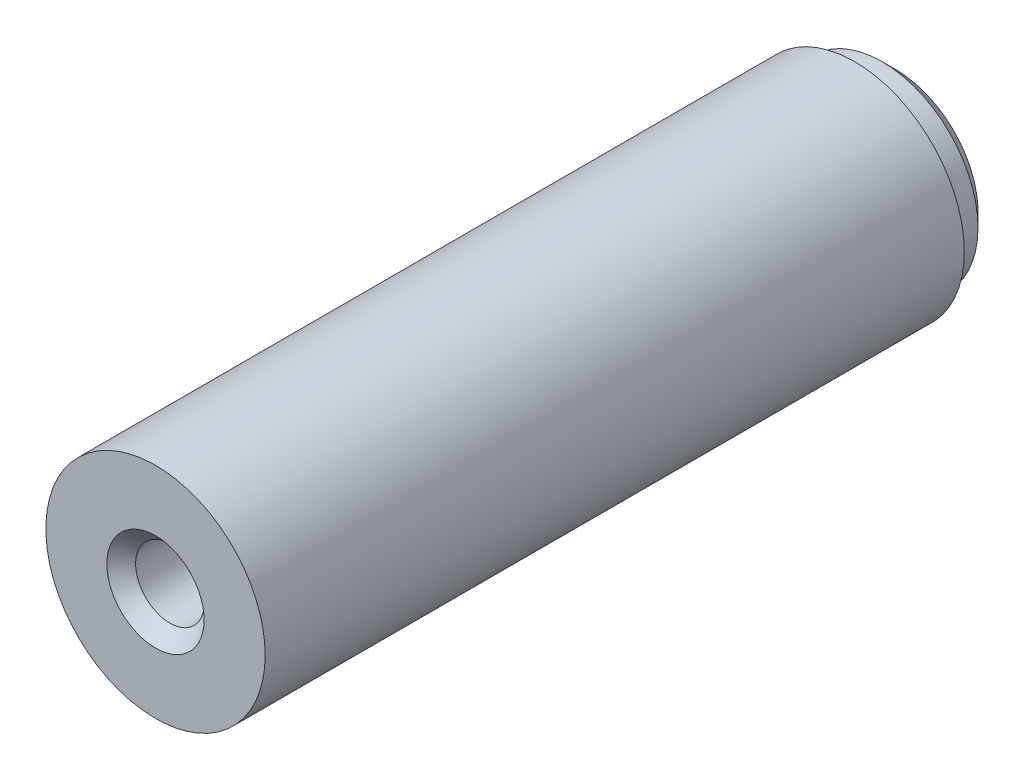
SolidWorks part; units mm, degrees
ref_plane "Přední rovina" through (0, 0, 0) normal (0, 0, 1) x (1, 0, 0)
ref_plane "Horní rovina" through (0, 0, 0) normal (0, 1, 0) x (1, 0, 0)
ref_plane "Pravá rovina" through (0, 0, 0) normal (1, 0, 0) x (0, 0, -1)
sketch "Skica1" plane through (0, 0, 0) normal (0, 0, 1) x (1, 0, 0)
  circle A0 centre (0, 0) radius 4
  dimension "D1" = 8
extrude "Přidat vysunutím1" add sketch "Skica1" along normal blind 25.5
hole_wizard "M3 závit1" positions "Skica3" profile "Skica2" tap size "M3" standard "ISO"
sketch "Skica3" plane through (0, 0, 25.5) normal (0, 0, 1) x (1, 0, 0)
  point P0 (0, 0)
sketch "Skica2" plane through (0, 0, 25.5) normal (1, 0, 0) x (0, -1, 0)
  line L0 (0, 0) -> (0, 15.7511)
  line L1 (0, 15.7511) -> (1.25, 15)
  line L2 (1.25, 15) -> (1.25, 0.525)
  line L3 (1.25, 0.525) -> (1.775, 0)
  line L5 (1.775, 0) -> (0, 0)
  line L6 (-1.25, 0.525) -> (-1.775, 0) construction
  line L10 (0, 15.7511) -> (-1.25, 15) construction
  line L11 (0, -6.35) -> (0, 107.95) construction
  dimension "Průměr závitníku" = 2.5
  dimension "Hloubka závitníku" = 15
  dimension "Průměr blíz. kuž. zahloubení" = 3.55
  dimension "Úhel blíz. kuž. zahloubení" = 90
  dimension "Úhel vrtání" = 118
sketch "Skica4" plane through (0, 0, 0) normal (0, 0, -1) x (-1, 0, 0)
  circle A0 centre (0, 0) radius 3.5
extrude "Přidat vysunutím2" add sketch "Skica4" along normal blind 1.5
chamfer "Zkosení1" distance 0.5 angle 45 1 edges at (-3.5, 0, -1.5)
